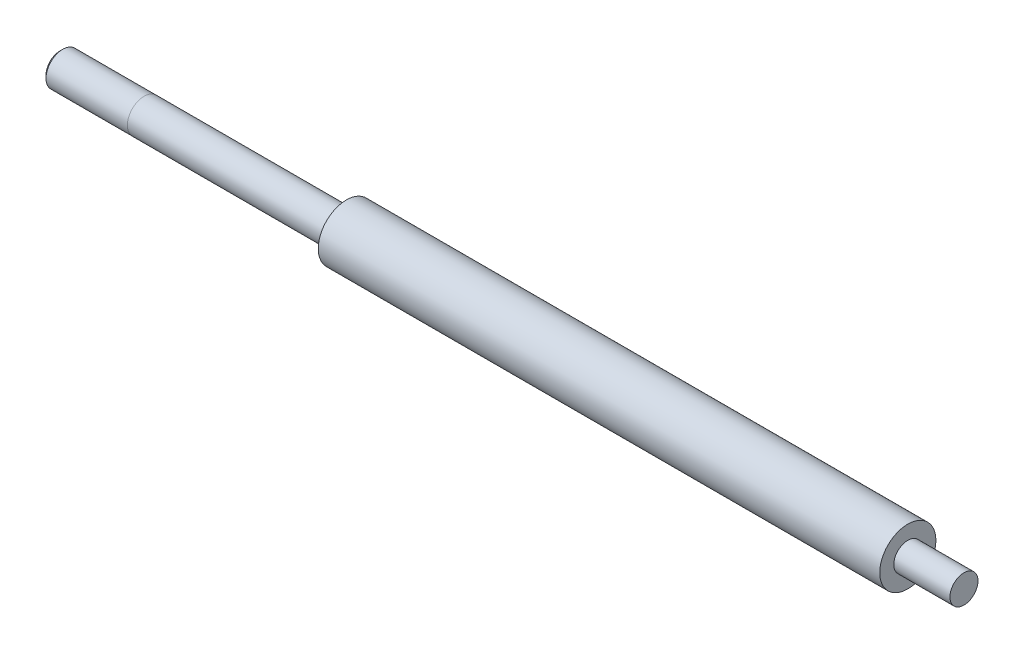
SolidWorks part; units mm, degrees
ref_plane "Front" through (0, 0, 0) normal (0, 0, 1) x (1, 0, 0)
ref_plane "Top" through (0, 0, 0) normal (0, 1, 0) x (1, 0, 0)
ref_plane "Right" through (0, 0, 0) normal (1, 0, 0) x (0, 0, -1)
sketch "Sketch1" plane through (0, 0, 0) normal (1, 0, 0) x (0, 0, -1)
  circle A0 centre (0, 0) radius 5
extrude "Extrude1" add sketch "Sketch1" along normal blind 100
sketch "Sketch2" plane through (100, 0, 0) normal (1, 0, 0) x (0, 0, -1)
  circle A0 centre (0, 0) radius 2.5
extrude "Extrude2" add sketch "Sketch2" along normal blind 10
sketch "Sketch3" plane through (0, 0, 0) normal (-1, 0, 0) x (0, 0, 1)
  circle A0 centre (0, 0) radius 3
extrude "Extrude3" add sketch "Sketch3" along normal blind 51
sketch "Sketch4" plane through (-51, 0, 0) normal (-1, 0, 0) x (0, 0, 1)
  circle A0 centre (0, 0) radius 9.9067
  circle A1 centre (0, 0) radius 2.99
extrude "Cut-Extrude1" cut sketch "Sketch4" against normal blind 15
chamfer "Chamfer1" distance 0.5 angle 45 1 edges at (-51, 0, 2.99)
